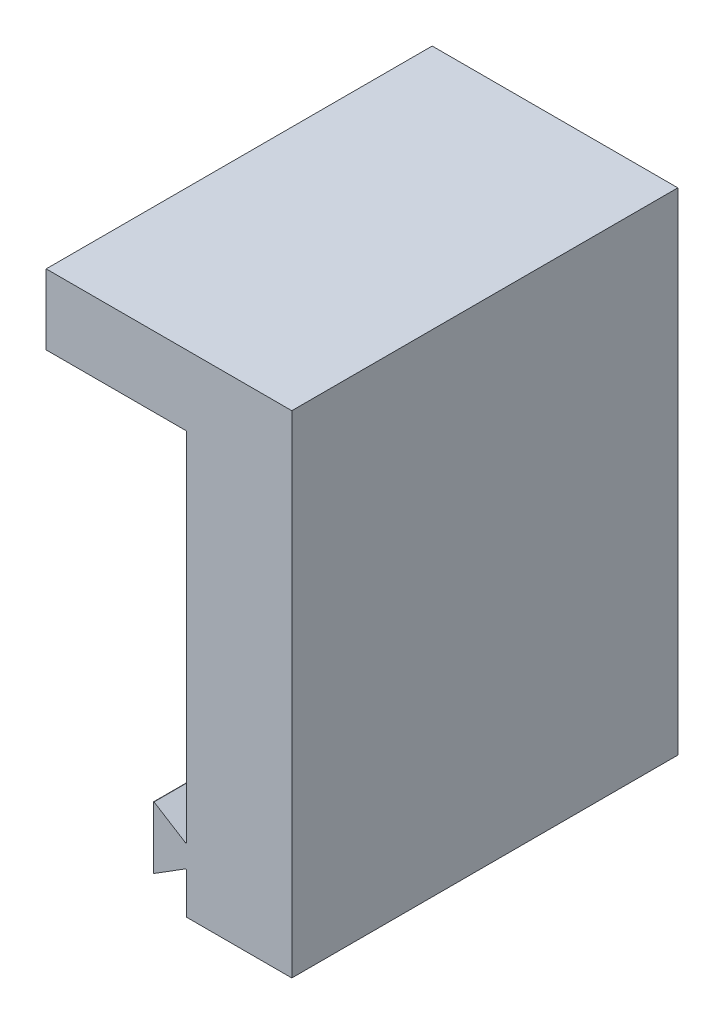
SolidWorks part; units mm, degrees
ref_plane "Front Plane" through (0, 0, 0) normal (0, 0, 1) x (1, 0, 0)
ref_plane "Top Plane" through (0, 0, 0) normal (0, 1, 0) x (1, 0, 0)
ref_plane "Right Plane" through (0, 0, 0) normal (1, 0, 0) x (0, 0, -1)
sketch "Sketch1" plane through (0, 0, 0) normal (0, 0, 1) x (1, 0, 0)
  line L0 (0, -108.75) -> (0, -101.25)
  line L1 (0, 0) -> (30, 0)
  line L2 (0, 0) -> (0, -120)
  line L3 (0, -120) -> (30, -120)
  line L4 (30, 0) -> (30, -120)
  line L5 (0, -101.25) -> (10.0021, -95)
  line L6 (10.0021, -95) -> (10.0021, -115)
  line L7 (10.0021, -115) -> (0, -108.75)
  line L8 (0, -101.25) -> (-10.0021, -95)
  line L9 (-10.0021, -95) -> (-10.0021, -115)
  line L10 (-10.0021, -115) -> (0, -108.75)
  line L11 (-0.318, -101.7588) -> (-9.4021, -96.0824)
  line L12 (-9.4021, -96.0824) -> (-9.4021, -113.9176)
  line L13 (-9.4021, -113.9176) -> (-0.318, -108.2412)
  line L14 (-0.318, -108.2412) -> (0, -108.2412)
  line L15 (0, -108.2412) -> (0, -101.7588)
  line L16 (0, -101.7588) -> (-0.318, -101.7588)
  dimension "D1" = 120
  dimension "D2" = 30
  dimension "D3" = 58
  dimension "D4" = 58
  dimension "D5" = 7.5
  dimension "D6" = 20
  dimension "D7" = 11.25
extrude "Boss-Extrude3" add sketch "Sketch1" along normal blind 110 contours L6 L7 L2 L3 L4 L1 L5 | L7 L6 L5 L0 L2 | L2 L16 L11 L12 L13 L14
fillet "Fillet2" radius 0.1 2 edges at (-9.4021, -113.9176, 55) (-9.4021, -96.0824, 55)
sketch "Sketch3" plane through (0, 0, 0) normal (0, 1, 0) x (1, 0, 0)
  line L1 (30, 0) -> (-40, 0)
  line L2 (30, 0) -> (30, -110)
  line L3 (30, -110) -> (-40, -110)
  line L4 (-40, 0) -> (-40, -110)
  dimension "D1" = 110
  dimension "D2" = 70
extrude "Boss-Extrude4" add sketch "Sketch3" along normal blind 20
sketch "Sketch4" plane through (0, 0, 0) normal (0, -1, 0) x (1, 0, 0)
  line L0 (0, 110) -> (0, 0) construction
  line L1 (0, 25) -> (-10, 25)
  line L2 (0, 25) -> (0, 35)
  line L3 (0, 35) -> (-10, 35)
  line L4 (-10, 25) -> (-10, 35)
  line L5 (0, 0) -> (-40, 0) construction
  line L6 (-40, 110) -> (0, 110) construction
  line L7 (0, 85) -> (-10, 85)
  line L8 (0, 85) -> (0, 75)
  line L9 (0, 75) -> (-10, 75)
  line L10 (-10, 85) -> (-10, 75)
  dimension "D1" = 10
  dimension "D2" = 10
  dimension "D3" = 25
  dimension "D4" = 25
  dimension "D5" = 10
  dimension "D6" = 10
extrude "Cut-Extrude1" cut sketch "Sketch4" along normal blind 140
